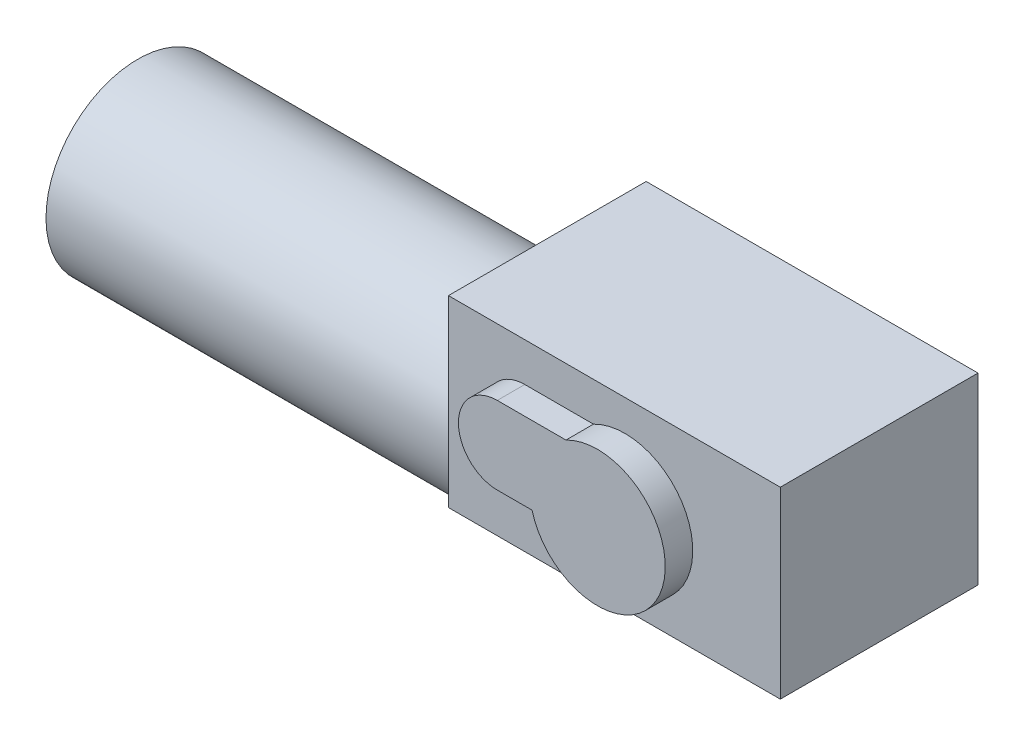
SolidWorks part; units mm, degrees
ref_plane "Front Plane" through (0, 0, 0) normal (0, 0, 1) x (1, 0, 0)
ref_plane "Top Plane" through (0, 0, 0) normal (0, 1, 0) x (1, 0, 0)
ref_plane "Right Plane" through (0, 0, 0) normal (1, 0, 0) x (0, 0, -1)
sketch "Sketch1" plane through (0, 0, 0) normal (1, 0, 0) x (0, 0, -1)
  circle A0 centre (0, 0) radius 41.275
  dimension "D1" = 82.55
extrude "Extrude1" add sketch "Sketch1" along normal blind 184.15
sketch "Sketch2" plane through (184.15, 0, 0) normal (1, 0, 0) x (0, 0, -1)
  line L0 (44.45, -19.05) -> (44.45, 63.5)
  line L1 (44.45, 63.5) -> (-44.45, 63.5)
  line L3 (0, -19.05) -> (44.45, -19.05)
  line L4 (-44.45, 63.5) -> (-44.45, -19.05)
  line L5 (0, -19.05) -> (-44.45, -19.05)
  dimension "D1" = 44.45
  dimension "D3" = 82.55
  dimension "D4" = 88.9
extrude "Extrude2" add sketch "Sketch2" along normal blind 149.225
sketch "Sketch3" plane through (0, 0, 0) normal (0, 0, 1) x (1, 0, 0)
  line L2 (184.15, 63.5) -> (184.15, -19.05) construction
  line L3 (333.375, 63.5) -> (184.15, 63.5) construction
  line L4 (218.4781, 46.0381) -> (249.3591, 46.0381)
  line L5 (218.4781, 11.1119) -> (234.0968, 11.1119)
  arc A0 (234.0968, 11.1119) -> (249.3591, 46.0381) centre (263.525, 19.05) ccw
  arc A1 (218.4781, 46.0381) -> (218.4781, 11.1119) centre (218.4781, 28.575) ccw
  dimension "D3" = 60.96
  dimension "D1" = 79.375
  dimension "D2" = 44.45
  dimension "D4" = 34.3281
  dimension "D5" = 34.925
extrude "Extrude3" add sketch "Sketch3" along normal blind 56.8198 and the other way blind 56.8198
